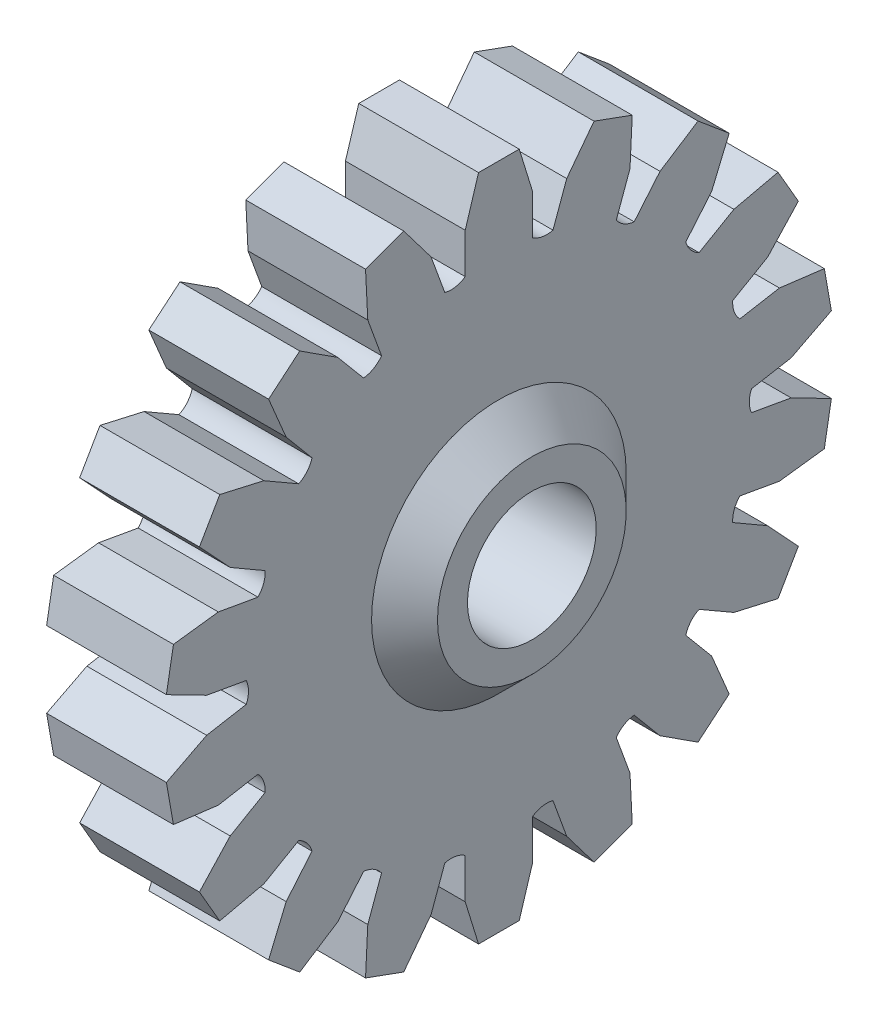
SolidWorks part; units mm, degrees
ref_plane "Front Plane" through (0, 0, 0) normal (0, 0, 1) x (1, 0, 0)
ref_plane "Top Plane" through (0, 0, 0) normal (0, 1, 0) x (1, 0, 0)
ref_plane "Right Plane" through (0, 0, 0) normal (1, 0, 0) x (0, 0, -1)
sketch "Sketch1" plane through (0, 0, 0) normal (1, 0, 0) x (0, 0, -1)
  line L0 (-0.3596, 11.5) -> (0.3596, 11.5)
  line L1 (0.3596, 11.5) -> (0.775, 9.202)
  line L2 (-0.3596, 11.5) -> (-0.775, 9.202)
  line L3 (4.2712, 10.6835) -> (3.8755, 8.382)
  line L4 (3.5953, 10.9295) -> (2.4191, 8.9121)
  line L5 (3.5953, 10.9295) -> (4.2712, 10.6835)
  line L6 (7.6675, 8.5784) -> (6.5086, 6.551)
  line L7 (7.1166, 9.0407) -> (5.3213, 7.5473)
  line L8 (7.1166, 9.0407) -> (7.6675, 8.5784)
  line L9 (10.1391, 5.4386) -> (8.3567, 3.9299)
  line L10 (9.7795, 6.0614) -> (7.5817, 5.2721)
  line L11 (9.7795, 6.0614) -> (10.1391, 5.4386)
  line L12 (11.3877, 1.6428) -> (9.1968, 0.8347)
  line L13 (11.2628, 2.3511) -> (8.9276, 2.3611)
  line L14 (11.2628, 2.3511) -> (11.3877, 1.6428)
  line L15 (11.2628, -2.3511) -> (8.9276, -2.3611)
  line L16 (11.3877, -1.6428) -> (9.1968, -0.8347)
  line L17 (11.3877, -1.6428) -> (11.2628, -2.3511)
  line L18 (9.7795, -6.0614) -> (7.5817, -5.2721)
  line L19 (10.1391, -5.4386) -> (8.3567, -3.9299)
  line L20 (10.1391, -5.4386) -> (9.7795, -6.0614)
  line L21 (7.1166, -9.0407) -> (5.3213, -7.5473)
  line L22 (7.6675, -8.5784) -> (6.5086, -6.551)
  line L23 (7.6675, -8.5784) -> (7.1166, -9.0407)
  line L24 (3.5953, -10.9295) -> (2.4191, -8.9121)
  line L25 (4.2712, -10.6835) -> (3.8755, -8.382)
  line L26 (4.2712, -10.6835) -> (3.5953, -10.9295)
  line L27 (-0.3596, -11.5) -> (-0.775, -9.202)
  line L28 (0.3596, -11.5) -> (0.775, -9.202)
  line L29 (0.3596, -11.5) -> (-0.3596, -11.5)
  line L30 (-4.2712, -10.6835) -> (-3.8755, -8.382)
  line L31 (-3.5953, -10.9295) -> (-2.4191, -8.9121)
  line L32 (-3.5953, -10.9295) -> (-4.2712, -10.6835)
  line L33 (-7.6675, -8.5784) -> (-6.5086, -6.551)
  line L34 (-7.1166, -9.0407) -> (-5.3213, -7.5473)
  line L35 (-7.1166, -9.0407) -> (-7.6675, -8.5784)
  line L36 (-10.1391, -5.4386) -> (-8.3567, -3.9299)
  line L37 (-9.7795, -6.0614) -> (-7.5817, -5.2721)
  line L38 (-9.7795, -6.0614) -> (-10.1391, -5.4386)
  line L39 (-11.3877, -1.6428) -> (-9.1968, -0.8347)
  line L40 (-11.2628, -2.3511) -> (-8.9276, -2.3611)
  line L41 (-11.2628, -2.3511) -> (-11.3877, -1.6428)
  line L42 (-11.2628, 2.3511) -> (-8.9276, 2.3611)
  line L43 (-11.3877, 1.6428) -> (-9.1968, 0.8347)
  line L44 (-11.3877, 1.6428) -> (-11.2628, 2.3511)
  line L45 (-9.7795, 6.0614) -> (-7.5817, 5.2721)
  line L46 (-10.1391, 5.4386) -> (-8.3567, 3.9299)
  line L47 (-10.1391, 5.4386) -> (-9.7795, 6.0614)
  line L48 (-7.1166, 9.0407) -> (-5.3213, 7.5473)
  line L49 (-7.6675, 8.5784) -> (-6.5086, 6.551)
  line L50 (-7.6675, 8.5784) -> (-7.1166, 9.0407)
  line L51 (-3.5953, 10.9295) -> (-2.4191, 8.9121)
  line L52 (-4.2712, 10.6835) -> (-3.8755, 8.382)
  line L53 (-4.2712, 10.6835) -> (-3.5953, 10.9295)
  line L54 (0.775, 9.202) -> (2.4191, 8.9121) construction
  circle A0 centre (0, 0) radius 11.5 construction
  circle A1 centre (0, 0) radius 3.03
  arc A2 (0.775, 9.202) -> (2.4191, 8.9121) centre (1.597, 9.0571) ccw
  arc A3 (3.8755, 8.382) -> (5.3213, 7.5473) centre (4.5984, 7.9647) ccw
  arc A4 (6.5086, 6.551) -> (7.5817, 5.2721) centre (7.0452, 5.9116) ccw
  arc A5 (8.3567, 3.9299) -> (8.9276, 2.3611) centre (8.6422, 3.1455) ccw
  arc A6 (9.1968, 0.8347) -> (9.1968, -0.8347) centre (9.1968, 0) ccw
  arc A7 (8.9276, -2.3611) -> (8.3567, -3.9299) centre (8.6422, -3.1455) ccw
  arc A8 (7.5817, -5.2721) -> (6.5086, -6.551) centre (7.0452, -5.9116) ccw
  arc A9 (5.3213, -7.5473) -> (3.8755, -8.382) centre (4.5984, -7.9647) ccw
  arc A10 (2.4191, -8.9121) -> (0.775, -9.202) centre (1.597, -9.0571) ccw
  arc A11 (-0.775, -9.202) -> (-2.4191, -8.9121) centre (-1.597, -9.0571) ccw
  arc A12 (-3.8755, -8.382) -> (-5.3213, -7.5473) centre (-4.5984, -7.9647) ccw
  arc A13 (-6.5086, -6.551) -> (-7.5817, -5.2721) centre (-7.0452, -5.9116) ccw
  arc A14 (-8.3567, -3.9299) -> (-8.9276, -2.3611) centre (-8.6422, -3.1455) ccw
  arc A15 (-9.1968, -0.8347) -> (-9.1968, 0.8347) centre (-9.1968, 0) ccw
  arc A16 (-8.9276, 2.3611) -> (-8.3567, 3.9299) centre (-8.6422, 3.1455) ccw
  arc A17 (-7.5817, 5.2721) -> (-6.5086, 6.551) centre (-7.0452, 5.9116) ccw
  arc A18 (-5.3213, 7.5473) -> (-3.8755, 8.382) centre (-4.5984, 7.9647) ccw
  arc A19 (-2.4191, 8.9121) -> (-0.775, 9.202) centre (-1.597, 9.0571) ccw
  point P8 (0, 0)
  dimension "D1" = 23
  dimension "D2" = 6.06
extrude "Boss-Extrude1" add sketch "Sketch1" along normal blind 4
sketch "Sketch2" plane through (4, 0, 0) normal (1, 0, 0) x (0, 0, -1)
  circle A0 centre (0, 0) radius 3.1514
  circle A1 centre (0, 0) radius 4.252
extrude "Boss-Extrude2" add sketch "Sketch2" along normal blind 2
chamfer "Chamfer1" distance 2 angle 45 1 edges at (6, 0, -4.252)
sketch "Sketch3" plane through (0, 0, 0) normal (-1, 0, 0) x (0, 0, 1)
  circle A0 centre (0, 0) radius 2.1
  circle A1 centre (0, 0) radius 3.03
  dimension "D1" = 4.2
extrude "Boss-Extrude3" add sketch "Sketch3" against normal through all
sketch "Sketch4" plane through (5.1007, 0, 0) normal (1, 0, 0) x (0, 0, -1)
  circle A0 centre (0, 0) radius 3.03
  circle A1 centre (0, 0) radius 3.1514
extrude "Boss-Extrude4" add sketch "Sketch4" against normal up to surface (1.1007 mm away)
sketch "Sketch5" plane through (0, 0, 0) normal (-1, 0, 0) x (0, 0, 1)
  circle A0 centre (0, 0) radius 2.15
  dimension "D1" = 4.3
extrude "Cut-Extrude1" cut sketch "Sketch5" against normal through all
sketch "Sketch6" plane through (4, 0, 0) normal (1, 0, 0) x (0, 0, -1)
  circle A0 centre (0, 0) radius 11.1556
  circle A1 centre (0, 0) radius 11.5056 construction
  dimension "D1" = 0.35
extrude "Cut-Extrude2" cut sketch "Sketch6" against normal blind 10 flip side to cut
sketch "Sketch7" plane through (0, 0, 0) normal (-1, 0, 0) x (0, 0, 1)
  line L0 (-0.6789, 11.1556) -> (0.6789, 11.1556)
  line L1 (0.6789, 11.1556) -> (1.1245, 9.7116)
  line L2 (1.1245, 9.7116) -> (1.1245, 7.9057)
  line L3 (1.1245, 7.9057) -> (-1.1245, 7.9057)
  line L4 (0, 11.1556) -> (0, 10.5602) construction
  line L5 (-1.1245, 9.7116) -> (-1.1245, 7.9057)
  line L6 (-0.6789, 11.1556) -> (-1.1245, 9.7116)
  line L7 (3.1775, 10.715) -> (4.4534, 10.2507)
  line L8 (4.4534, 10.2507) -> (4.3782, 8.7413)
  line L9 (4.3782, 8.7413) -> (3.7606, 7.0444)
  line L10 (3.7606, 7.0444) -> (1.6473, 7.8136)
  line L11 (2.2649, 9.5105) -> (1.6473, 7.8136)
  line L12 (3.1775, 10.715) -> (2.2649, 9.5105)
  line L13 (3.8154, 10.4829) -> (3.6118, 9.9234) construction
  line L14 (6.6506, 8.9821) -> (7.6908, 8.1093)
  line L15 (7.6908, 8.1093) -> (7.1039, 6.7167)
  line L16 (7.1039, 6.7167) -> (5.9431, 5.3333)
  line L17 (5.9431, 5.3333) -> (4.2203, 6.779)
  line L18 (5.3811, 8.1623) -> (4.2203, 6.779)
  line L19 (6.6506, 8.9821) -> (5.3811, 8.1623)
  line L20 (7.1707, 8.5457) -> (6.788, 8.0896) construction
  line L21 (9.3216, 6.1657) -> (10.0005, 4.9899)
  line L22 (10.0005, 4.9899) -> (8.9727, 3.882)
  line L23 (8.9727, 3.882) -> (7.4088, 2.979)
  line L24 (7.4088, 2.979) -> (6.2843, 4.9267)
  line L25 (7.8482, 5.8296) -> (6.2843, 4.9267)
  line L26 (9.3216, 6.1657) -> (7.8482, 5.8296)
  line L27 (9.6611, 5.5778) -> (9.1454, 5.2801) construction
  line L28 (10.8683, 2.6057) -> (11.104, 1.2686)
  line L29 (11.104, 1.2686) -> (9.7593, 0.579)
  line L30 (9.7593, 0.579) -> (7.9809, 0.2654)
  line L31 (7.9809, 0.2654) -> (7.5904, 2.4802)
  line L32 (9.3688, 2.7938) -> (7.5904, 2.4802)
  line L33 (10.8683, 2.6057) -> (9.3688, 2.7938)
  line L34 (10.9861, 1.9372) -> (10.3998, 1.8338) construction
  line L35 (11.104, -1.2686) -> (10.8683, -2.6057)
  line L36 (10.8683, -2.6057) -> (9.3688, -2.7938)
  line L37 (9.3688, -2.7938) -> (7.5904, -2.4802)
  line L38 (7.5904, -2.4802) -> (7.9809, -0.2654)
  line L39 (9.7593, -0.579) -> (7.9809, -0.2654)
  line L40 (11.104, -1.2686) -> (9.7593, -0.579)
  line L41 (10.9861, -1.9372) -> (10.3998, -1.8338) construction
  line L42 (10.0005, -4.9899) -> (9.3216, -6.1657)
  line L43 (9.3216, -6.1657) -> (7.8482, -5.8296)
  line L44 (7.8482, -5.8296) -> (6.2843, -4.9267)
  line L45 (6.2843, -4.9267) -> (7.4088, -2.979)
  line L46 (8.9727, -3.882) -> (7.4088, -2.979)
  line L47 (10.0005, -4.9899) -> (8.9727, -3.882)
  line L48 (9.6611, -5.5778) -> (9.1454, -5.2801) construction
  line L49 (7.6908, -8.1093) -> (6.6506, -8.9821)
  line L50 (6.6506, -8.9821) -> (5.3811, -8.1623)
  line L51 (5.3811, -8.1623) -> (4.2203, -6.779)
  line L52 (4.2203, -6.779) -> (5.9431, -5.3333)
  line L53 (7.1039, -6.7167) -> (5.9431, -5.3333)
  line L54 (7.6908, -8.1093) -> (7.1039, -6.7167)
  line L55 (7.1707, -8.5457) -> (6.788, -8.0896) construction
  line L56 (4.4534, -10.2507) -> (3.1775, -10.715)
  line L57 (3.1775, -10.715) -> (2.2649, -9.5105)
  line L58 (2.2649, -9.5105) -> (1.6473, -7.8136)
  line L59 (1.6473, -7.8136) -> (3.7606, -7.0444)
  line L60 (4.3782, -8.7413) -> (3.7606, -7.0444)
  line L61 (4.4534, -10.2507) -> (4.3782, -8.7413)
  line L62 (3.8154, -10.4829) -> (3.6118, -9.9234) construction
  line L63 (0.6789, -11.1556) -> (-0.6789, -11.1556)
  line L64 (-0.6789, -11.1556) -> (-1.1245, -9.7116)
  line L65 (-1.1245, -9.7116) -> (-1.1245, -7.9057)
  line L66 (-1.1245, -7.9057) -> (1.1245, -7.9057)
  line L67 (1.1245, -9.7116) -> (1.1245, -7.9057)
  line L68 (0.6789, -11.1556) -> (1.1245, -9.7116)
  line L69 (0, -11.1556) -> (0, -10.5602) construction
  line L70 (-3.1775, -10.715) -> (-4.4534, -10.2507)
  line L71 (-4.4534, -10.2507) -> (-4.3782, -8.7413)
  line L72 (-4.3782, -8.7413) -> (-3.7606, -7.0444)
  line L73 (-3.7606, -7.0444) -> (-1.6473, -7.8136)
  line L74 (-2.2649, -9.5105) -> (-1.6473, -7.8136)
  line L75 (-3.1775, -10.715) -> (-2.2649, -9.5105)
  line L76 (-3.8154, -10.4829) -> (-3.6118, -9.9234) construction
  line L77 (-6.6506, -8.9821) -> (-7.6908, -8.1093)
  line L78 (-7.6908, -8.1093) -> (-7.1039, -6.7167)
  line L79 (-7.1039, -6.7167) -> (-5.9431, -5.3333)
  line L80 (-5.9431, -5.3333) -> (-4.2203, -6.779)
  line L81 (-5.3811, -8.1623) -> (-4.2203, -6.779)
  line L82 (-6.6506, -8.9821) -> (-5.3811, -8.1623)
  line L83 (-7.1707, -8.5457) -> (-6.788, -8.0896) construction
  line L84 (-9.3216, -6.1657) -> (-10.0005, -4.9899)
  line L85 (-10.0005, -4.9899) -> (-8.9727, -3.882)
  line L86 (-8.9727, -3.882) -> (-7.4088, -2.979)
  line L87 (-7.4088, -2.979) -> (-6.2843, -4.9267)
  line L88 (-7.8482, -5.8296) -> (-6.2843, -4.9267)
  line L89 (-9.3216, -6.1657) -> (-7.8482, -5.8296)
  line L90 (-9.6611, -5.5778) -> (-9.1454, -5.2801) construction
  line L91 (-10.8683, -2.6057) -> (-11.104, -1.2686)
  line L92 (-11.104, -1.2686) -> (-9.7593, -0.579)
  line L93 (-9.7593, -0.579) -> (-7.9809, -0.2654)
  line L94 (-7.9809, -0.2654) -> (-7.5904, -2.4802)
  line L95 (-9.3688, -2.7938) -> (-7.5904, -2.4802)
  line L96 (-10.8683, -2.6057) -> (-9.3688, -2.7938)
  line L97 (-10.9861, -1.9372) -> (-10.3998, -1.8338) construction
  line L98 (-11.104, 1.2686) -> (-10.8683, 2.6057)
  line L99 (-10.8683, 2.6057) -> (-9.3688, 2.7938)
  line L100 (-9.3688, 2.7938) -> (-7.5904, 2.4802)
  line L101 (-7.5904, 2.4802) -> (-7.9809, 0.2654)
  line L102 (-9.7593, 0.579) -> (-7.9809, 0.2654)
  line L103 (-11.104, 1.2686) -> (-9.7593, 0.579)
  line L104 (-10.9861, 1.9372) -> (-10.3998, 1.8338) construction
  line L105 (-10.0005, 4.9899) -> (-9.3216, 6.1657)
  line L106 (-9.3216, 6.1657) -> (-7.8482, 5.8296)
  line L107 (-7.8482, 5.8296) -> (-6.2843, 4.9267)
  line L108 (-6.2843, 4.9267) -> (-7.4088, 2.979)
  line L109 (-8.9727, 3.882) -> (-7.4088, 2.979)
  line L110 (-10.0005, 4.9899) -> (-8.9727, 3.882)
  line L111 (-9.6611, 5.5778) -> (-9.1454, 5.2801) construction
  line L112 (-7.6908, 8.1093) -> (-6.6506, 8.9821)
  line L113 (-6.6506, 8.9821) -> (-5.3811, 8.1623)
  line L114 (-5.3811, 8.1623) -> (-4.2203, 6.779)
  line L115 (-4.2203, 6.779) -> (-5.9431, 5.3333)
  line L116 (-7.1039, 6.7167) -> (-5.9431, 5.3333)
  line L117 (-7.6908, 8.1093) -> (-7.1039, 6.7167)
  line L118 (-7.1707, 8.5457) -> (-6.788, 8.0896) construction
  line L119 (-4.4534, 10.2507) -> (-3.1775, 10.715)
  line L120 (-3.1775, 10.715) -> (-2.2649, 9.5105)
  line L121 (-2.2649, 9.5105) -> (-1.6473, 7.8136)
  line L122 (-1.6473, 7.8136) -> (-3.7606, 7.0444)
  line L123 (-4.3782, 8.7413) -> (-3.7606, 7.0444)
  line L124 (-4.4534, 10.2507) -> (-4.3782, 8.7413)
  line L125 (-3.8154, 10.4829) -> (-3.6118, 9.9234) construction
  arc A0 (0.4233, 11.1476) -> (-0.4233, 11.1476) centre (0, 0) ccw construction
  point P11 (0, 7.9057)
  point P23 (2.7039, 7.429)
  point P32 (5.0817, 6.0562)
  point P41 (6.8466, 3.9529)
  point P50 (7.7856, 1.3728)
  point P59 (7.7856, -1.3728)
  point P68 (6.8466, -3.9529)
  point P77 (5.0817, -6.0562)
  point P86 (2.7039, -7.429)
  point P95 (0, -7.9057)
  point P104 (-2.7039, -7.429)
  point P113 (-5.0817, -6.0562)
  point P122 (-6.8466, -3.9529)
  point P131 (-7.7856, -1.3728)
  point P140 (-7.7856, 1.3728)
  point P149 (-6.8466, 3.9529)
  point P158 (-5.0817, 6.0562)
  point P167 (-2.7039, 7.429)
  point P169 (0, 0)
  dimension "D1" = 18
extrude "Boss-Extrude5" add sketch "Sketch7" against normal up to surface (4 mm away)
